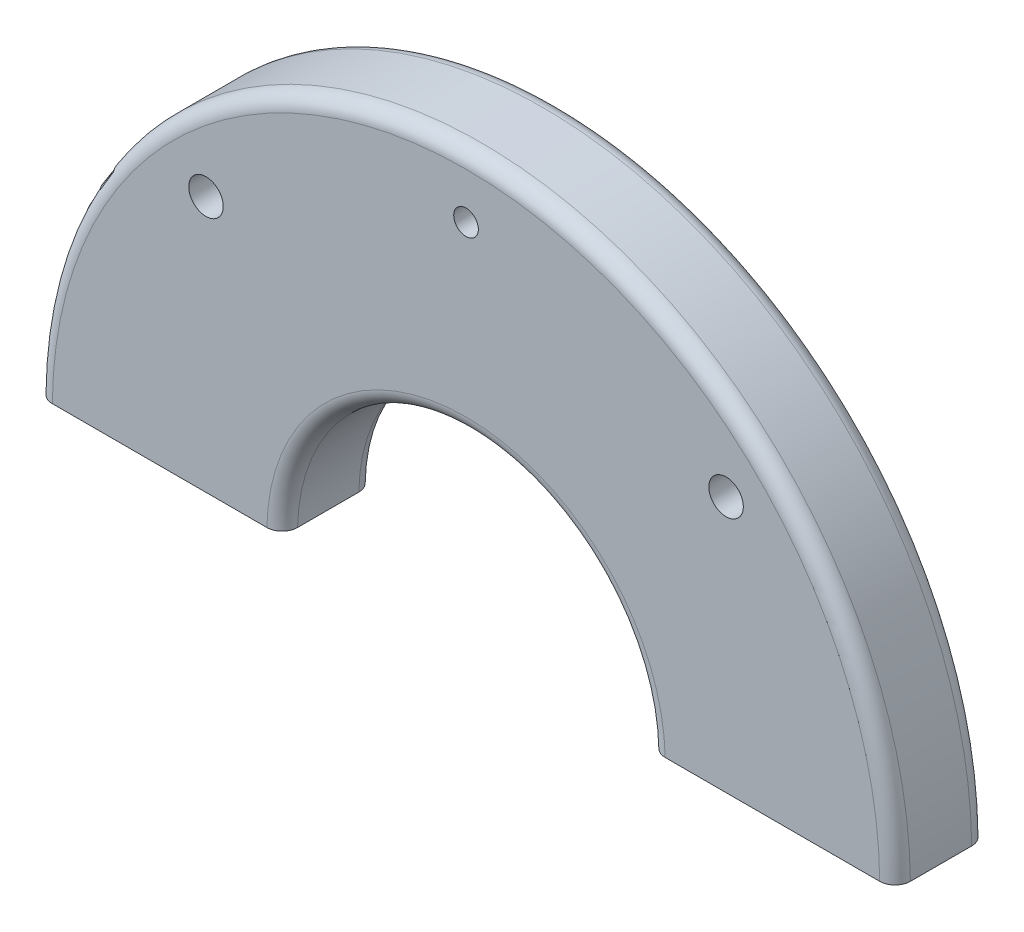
SolidWorks part; units mm, degrees
ref_plane "Front Plane" through (0, 0, 0) normal (0, 0, 1) x (1, 0, 0)
ref_plane "Top Plane" through (0, 0, 0) normal (0, 1, 0) x (1, 0, 0)
ref_plane "Right Plane" through (0, 0, 0) normal (1, 0, 0) x (0, 0, -1)
sketch "Sketch1" plane through (0, 0, 0) normal (0, 0, 1) x (1, 0, 0)
  circle A0 centre (0, 0) radius 88.9
  circle A1 centre (0, 0) radius 38.1
  dimension "D1" = 177.8
  dimension "D2" = 76.2
extrude "Boss-Extrude1" add sketch "Sketch1" along normal mid plane 19.05
hole_wizard "1/4 Clearance Hole1" positions "Sketch10" profile "Sketch11" hole size "1/4" standard "ANSI Inch"
sketch "Sketch10" plane through (0, 0, 9.525) normal (0, 0, 1) x (1, 0, 0)
  line L2 (0, 0) -> (-88.9, 0)
  line L4 (0, 0) -> (0, 88.9)
  line L6 (-88.9, 0) -> (0, 88.9)
  line L8 (0, 0) -> (-53.8815, 53.8815)
  circle A0 centre (0, 0) radius 88.9 construction
  point P13 (-53.8815, 53.8815)
  point P48 (-44.45, 44.45)
  dimension "D1" = 76.2
sketch "Sketch11" plane through (-53.8815, 53.8815, 9.525) normal (1, 0, 0) x (0, -1, 0)
  line L0 (0, 0) -> (0, 19.05)
  line L1 (0, 19.05) -> (3.5712, 19.05)
  line L2 (3.5712, 19.05) -> (3.5712, 0)
  line L5 (3.5712, 0) -> (0, 0)
  line L11 (0, -6.35) -> (0, 107.95) construction
  dimension "Thru Hole Dia." = 7.1425
  dimension "Thru Hole Depth" = 19.05
pattern_circular "CirPattern1" count 4 over 360 of "1/4 Clearance Hole1"
sketch "Sketch12" plane through (0, 0, 9.525) normal (0, 0, 1) x (1, 0, 0)
  line L0 (-88.9, 0) -> (88.9, 0)
  line L1 (-88.9, -0.7937) -> (88.9, -0.7937)
  line L2 (-88.9, 0.7937) -> (88.9, 0.7937)
  circle A0 centre (0, 0) radius 88.9 construction
  circle A2 centre (0, 0) radius 88.9
  circle A3 centre (0, 0) radius 88.9
  dimension "D1" = 0.7937
  dimension "D2" = 0.7937
  dimension "D3" = 0
extrude "Cut-Extrude1" cut sketch "Sketch12" against normal through all contours L2 L0 M9 M10 | L1 L0 M9 M10 | L2 L0 M10 M9 | L1 L0 M10 M9
ref_plane "Plane1" through (0, 88.9, 0) normal (0, 1, 0) x (1, 0, 0)
hole_wizard "CBORE for 1/4 Socket Head Cap Screw1" positions "Sketch13" profile "Sketch15" counterbore size "1/4" standard "ANSI Inch"
sketch "Sketch13" plane through (0, 88.9, 0) normal (0, 1, 0) x (1, 0, 0)
  line L8 (-88.8965, -9.525) -> (-38.0917, -9.525)
  line L9 (-88.8965, 9.525) -> (-88.8965, -9.525)
  line L10 (-38.0917, 9.525) -> (-88.8965, 9.525)
  line L11 (-38.0917, -9.525) -> (-38.0917, 9.525)
  line L12 (-88.8965, -9.525) -> (-38.0917, -9.525)
  line L13 (-88.8965, 9.525) -> (-88.8965, -9.525)
  line L14 (-38.0917, 9.525) -> (-88.8965, 9.525)
  line L15 (-38.0917, -9.525) -> (-38.0917, 9.525)
  line L16 (-88.8965, 9.525) -> (-76.2, 0)
  line L17 (-76.2, 0) -> (-88.8965, -9.525)
  line L19 (0, -55) -> (0, 55) construction
  point P0 (-76.2, 0)
  dimension "D2" = 76.2
  dimension "D1" = 0
sketch "Sketch15" plane through (-76.2, 88.9, 0) normal (1, 0, 0) x (0, 0, 1)
  line L0 (0, 0) -> (0, 90.2511)
  line L1 (0, 90.2511) -> (3.5712, 88.1052)
  line L2 (3.5712, 88.1052) -> (3.5712, 76.2)
  line L3 (3.5712, 76.2) -> (5.5562, 76.2)
  line L4 (5.5562, 76.2) -> (5.5562, 0)
  line L5 (5.5562, 0) -> (0, 0)
  line L10 (0, 90.2511) -> (-3.5712, 88.1052) construction
  line L11 (0, -6.35) -> (0, 107.95) construction
  dimension "Hole Dia." = 7.1425
  dimension "Hole Depth" = 88.1052
  dimension "C'Bore Dia." = 11.1125
  dimension "C'Bore Depth" = 76.2
  dimension "Drill Angle" = 118
hole_wizard "1/4-20 Tapped Hole1" positions "Sketch18" profile "Sketch19" tap size "1/4-20" standard "ANSI Inch"
sketch "Sketch18" plane through (0, 0.7937, 0) normal (0, -1, 0) x (-1, 0, 0)
  line L2 (-76.2, 0) -> (-38.0917, 0)
  line L3 (-38.0917, 9.525) -> (-38.0917, -9.525) construction
  line L5 (0, 55) -> (0, -55) construction
  point P0 (-76.2, 0)
  dimension "D1" = 76.2
sketch "Sketch19" plane through (76.2, 0.7937, 0) normal (1, 0, 0) x (0, 0, -1)
  line L0 (0, 0) -> (0, 36.4588)
  line L1 (0, 36.4588) -> (2.5527, 34.925)
  line L2 (2.5527, 34.925) -> (2.5527, 0)
  line L5 (2.5527, 0) -> (0, 0)
  line L10 (0, 36.4588) -> (-2.5527, 34.925) construction
  line L11 (0, -6.35) -> (0, 107.95) construction
  dimension "Tap Drill Dia." = 5.1054
  dimension "Tap Drill Depth" = 34.925
  dimension "Drill Angle" = 118
sketch "Sketch20" plane through (0, 0, -9.525) normal (0, 0, -1) x (-1, 0, 0)
  line L2 (88.8965, -0.7937) -> (38.0917, -0.7937)
  line L3 (-38.0917, -0.7937) -> (-88.8965, -0.7937)
  line L4 (88.8965, -0.7937) -> (38.0917, -0.7937)
  line L5 (-38.0917, -0.7937) -> (-88.8965, -0.7937)
  arc A2 (-88.8965, -0.7937) -> (88.8965, -0.7937) centre (0, 0) ccw
  arc A3 (-38.0917, -0.7937) -> (38.0917, -0.7937) centre (0, 0) ccw
  arc A4 (-88.8965, -0.7937) -> (88.8965, -0.7937) centre (0, 0) ccw
  arc A5 (-38.0917, -0.7937) -> (38.0917, -0.7937) centre (0, 0) ccw
  dimension "D1" = 0
extrude "Cut-Extrude2" cut sketch "Sketch20" against normal through all
fillet "Fillet1" radius 3.175
hole_wizard "1/4-20 Tapped Hole2" positions "Sketch22" profile "Sketch23" tap size "1/4-20" standard "ANSI Inch"
sketch "Sketch22" plane through (0, 0, -9.525) normal (0, 0, -1) x (-1, 0, 0)
  line L0 (0, 55) -> (0, -55) construction
  line L1 (55, 0) -> (-55, 0) construction
  point P0 (0, 76.2)
  dimension "D1" = 76.2
sketch "Sketch23" plane through (0, 76.2, -9.525) normal (1, 0, 0) x (0, 1, 0)
  line L0 (0, 0) -> (0, 19.2291)
  line L1 (0, 19.2291) -> (2.5527, 19.2291)
  line L2 (2.5527, 19.2291) -> (2.5527, 0)
  line L5 (2.5527, 0) -> (0, 0)
  line L11 (0, -6.35) -> (0, 107.95) construction
  dimension "Thru Tap Drill Dia." = 5.1054
  dimension "Thru Tap Drill Depth" = 19.2291
